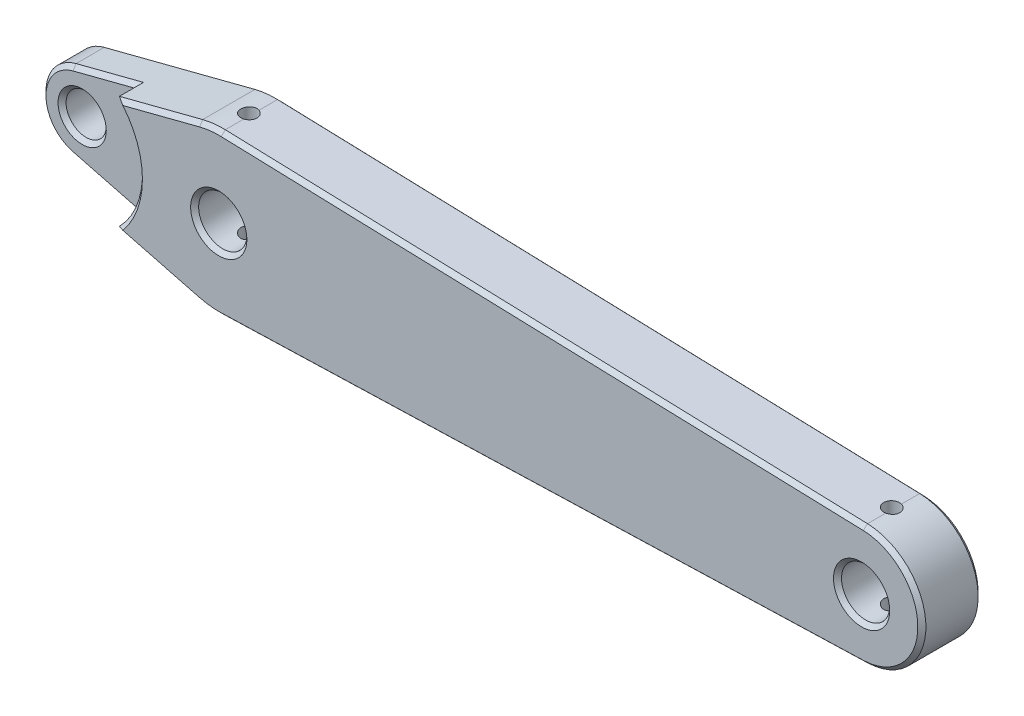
SolidWorks part; units mm, degrees
ref_plane "前视" through (0, 0, 0) normal (0, 0, 1) x (1, 0, 0)
ref_plane "上视" through (0, 0, 0) normal (0, 1, 0) x (1, 0, 0)
ref_plane "右视" through (0, 0, 0) normal (1, 0, 0) x (0, 0, -1)
sketch "草图1" plane through (0, 0, 0) normal (0, 0, 1) x (1, 0, 0)
  line L0 (-20, 0) -> (80, 0) construction
  line L1 (-21.25, 4.8412) -> (-2.5, 9.6825)
  line L2 (0.3125, 9.9951) -> (80.2344, 7.4963)
  line L3 (0.3125, -9.9951) -> (80.2344, -7.4963)
  line L4 (-21.25, -4.8412) -> (-2.5, -9.6825)
  circle A0 centre (-20, 0) radius 2.5
  circle A1 centre (0, 0) radius 3
  circle A2 centre (80, 0) radius 3
  arc A3 (-21.25, 4.8412) -> (-21.25, -4.8412) centre (-20, 0) ccw
  arc A4 (-2.5, -9.6825) -> (0.3125, -9.9951) centre (0, 0) ccw
  arc A5 (80.2344, -7.4963) -> (80.2344, 7.4963) centre (80, 0) ccw
  arc A6 (0.3125, 9.9951) -> (-2.5, 9.6825) centre (0, 0) ccw
  point P13 (84.5614, 12.1993)
  dimension "D1" = 80
  dimension "D2" = 20
  dimension "D3" = 6
  dimension "D4" = 6
  dimension "D5" = 5
  dimension "D6" = 10
  dimension "D7" = 20
  dimension "D8" = 15
extrude "凸台-拉伸1" add sketch "草图1" along normal mid plane 7.5
sketch "草图2" plane through (0, 0, 0) normal (0, 1, 0) x (1, 0, 0)
  line L0 (-35.8355, 0) -> (100.0094, 0) construction
  line L1 (80, 0) -> (80, 5.3314) construction
  line L2 (77, 3.75) -> (77, -3.75) construction
  line L3 (83, -3.75) -> (83, 3.75) construction
  circle A0 centre (0, 0) radius 1
  circle A1 centre (80, 0) radius 1
  dimension "D1" = 2
extrude "切除-拉伸1" cut sketch "草图2" against normal mid plane 40
sketch "草图3" plane through (0, 0, 3.75) normal (0, 0, 1) x (1, 0, 0)
  circle A0 centre (-20, 0) radius 10
  dimension "D1" = 20
extrude "切除-拉伸2" cut sketch "草图3" against normal blind 3
chamfer "倒角1" distance 0.5 angle 45 25 edges at (83, 0, -3.75) (3, 0, -3.75) (-17.5, 0, -3.75) (-11.875, 7.2618, -3.75) (-25, 0, -3.75) (-11.875, -7.2618, -3.75) (-1.1049, -9.9388, -3.75) (40.2734, -8.7457, -3.75) (87.5, 0, -3.75) (40.2734, 8.7457, -3.75) (-1.1049, 9.9388, -3.75) (83, 0, 3.75) (3, 0, 3.75) (-7.6824, 8.3444, 3.75) (-1.1049, 9.9388, 3.75) (40.2734, 8.7457, 3.75) (87.5, 0, 3.75) (40.2734, -8.7457, 3.75) (-1.1049, -9.9388, 3.75) (-7.6824, -8.3444, 3.75) (-10, 0, 3.75) (-17.0574, 5.9238, 0.75) (-25, 0, 0.75) (-17.0574, -5.9238, 0.75) (-17.5, 0, 0.75)
